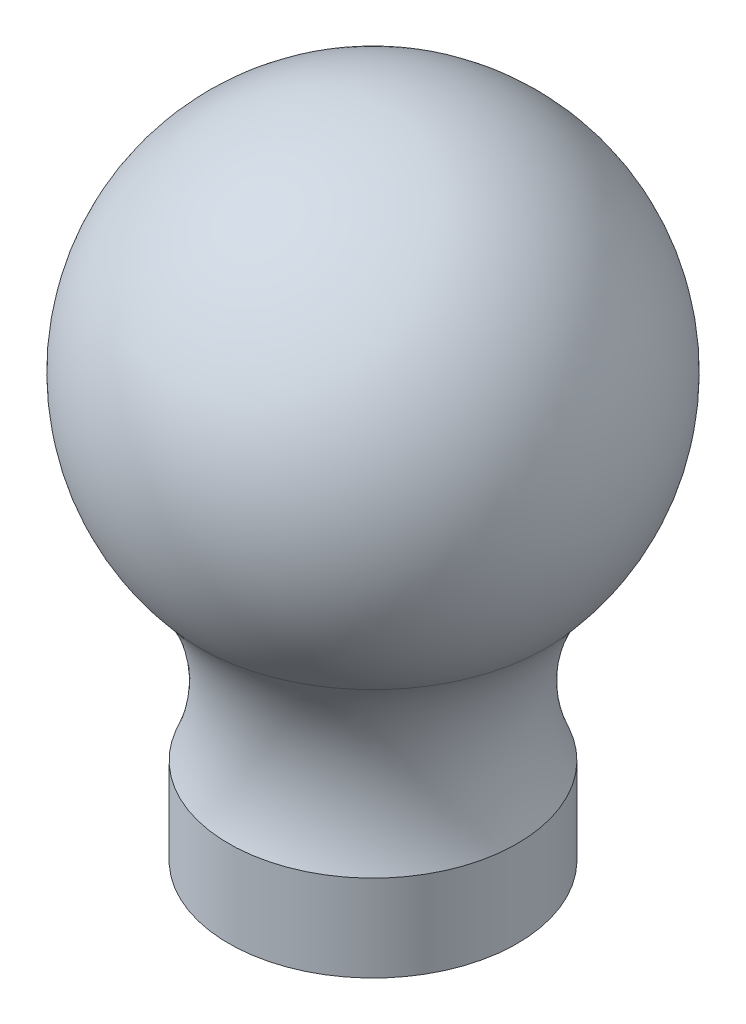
SolidWorks part; units mm, degrees
ref_plane "Спереди" through (0, 0, 0) normal (0, 0, 1) x (1, 0, 0)
ref_plane "Сверху" through (0, 0, 0) normal (0, 1, 0) x (1, 0, 0)
ref_plane "Справа" through (0, 0, 0) normal (1, 0, 0) x (0, 0, -1)
sketch "Эскиз1" plane through (0, 0, 0) normal (0, 0, 1) x (1, 0, 0)
  line L0 (0, 0) -> (0, 22.658) construction
  line L1 (0, 0) -> (5, 0)
  line L2 (5, 0) -> (5, 3)
  line L3 (0, 0) -> (0, 22.658)
  arc A0 (5, 3) -> (6, 9.3665) centre (10.5, 5.3979) cw
  arc A1 (6, 9.3665) -> (0, 22.658) centre (0, 14.658) ccw
  dimension "D2" = 6
  dimension "D3" = 8
  dimension "D1" = 10
  dimension "D4" = 3
  dimension "D5" = 9
revolve "Повернуть1" add sketch "Эскиз1" angle 360 about L0
sketch "Эскиз2" plane through (0, 0, 0) normal (0, -1, 0) x (1, 0, 0)
  circle A0 centre (0, 0) radius 1.875
  dimension "D1" = 3.75
extrude "Вырез-Вытянуть1" cut sketch "Эскиз2" against normal blind 20
